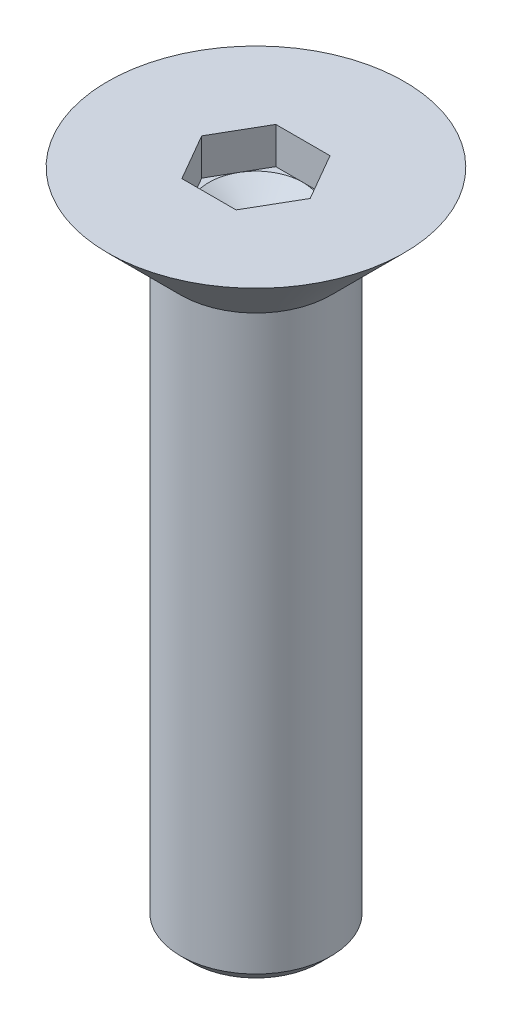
SolidWorks part; units mm, degrees
extrude "Base-Extrusion" add sketch "Esquisse2" against normal blind 35
sketch "Esquisse2" plane through (0, 0, 0) normal (0, 1, 0) x (1, 0, 0)
  circle A0 centre (0, 0) radius 4
  dimension "Diamètre nominal" = 8
chamfer "Chanfrein1" distance 0.625 angle 45
ref_plane "Plan1" through (0, 0, 0) normal (0, 0, 1) x (1, 0, 0)
ref_plane "Plan2" through (0, 0, 0) normal (0, 1, 0) x (1, 0, 0)
ref_plane "Plan3" through (0, 0, 0) normal (1, 0, 0) x (0, 0, -1)
sketch "Esquisse5" plane through (0, 0, 0) normal (0, 0, 1) x (1, 0, 0)
  line L0 (-7.9, 0) -> (7.9, 0) construction
  line L1 (0, 0) -> (7.9, 0)
  line L2 (7.9, 0) -> (4, -3.9)
  line L3 (4, -3.9) -> (0, -3.9)
  line L4 (4, -34.375) -> (4, 0) construction
  line L5 (0, -3.9) -> (0, 0)
  line L6 (0, 0) -> (0, -4.9812) construction
  line L8 (0, -34.375) -> (0, 0) construction
  line L9 (0, -4.9812) -> (0, 23.9688) construction
  line L10 (0, -34.375) -> (0, 0) construction
revolve "Boss.-Révol.1" add sketch "Esquisse5" angle 360 about L6
sketch "Esquisse7" plane through (0, 0, 0) normal (0, 1, 0) x (-1, 0, 0)
  circle A0 centre (0, 0) radius 2.5
  dimension "Cote sur plats" = 5
extrude "Enlèv. mat.-Extru.2" cut sketch "Esquisse7" against normal blind 1.95
sketch "Esquisse8" plane through (0, -1.95, 0) normal (0, 1, 0) x (-1, 0, 0)
  circle A0 centre (0, 0) radius 2.5
  circle A1 centre (0, 0) radius 2.5 construction
extrude "Enlèv. mat.-Extru.3" cut sketch "Esquisse8" against normal through all draft 60
sketch "Esquisse9" plane through (0, 0, 0) normal (0, 1, 0) x (-1, 0, 0)
  line L0 (0, -2.5) -> (0, 2.5) construction
  line L1 (2.5, 0) -> (-2.8868, 0) construction
  line L2 (0, 0) -> (-1.4434, 2.5) construction
  line L3 (0, 0) -> (-2.1651, 1.25) construction
  line L4 (1.4434, 2.5) -> (-1.4434, 2.5)
  line L5 (-1.4434, 2.5) -> (-2.8868, 0)
  line L6 (-1.4434, -2.5) -> (-2.8868, 0)
  line L7 (1.4434, -2.5) -> (-1.4434, -2.5)
  line L8 (1.4434, 2.5) -> (2.8868, 0)
  line L9 (1.4434, -2.5) -> (2.8868, 0)
  circle A0 centre (0, 0) radius 2.5 construction
  dimension "D1" = 30
  dimension "D2" = 30
extrude "Enlèv. mat.-Extru.4" cut sketch "Esquisse9" against normal blind 1.95
equation "\"D2@Esquisse5\" = \"Diamètre tête@Esquisse5\"/2"
equation "\"D1@Enlèv. mat.-Extru.2\" = (\"Diamètre tête@Esquisse5\"-\"Diamètre nominal@Esquisse2\")/4"
equation "\"D1@Enlèv. mat.-Extru.4\" = \"D1@Enlèv. mat.-Extru.2\""
equation "\"D2@Représentation de filetage1\" = \"Diamètre nominal@Esquisse2\"-(\"Diamètre nominal@Esquisse2\"*0.2)"
equation "\"Longueur filetée@Représentation de filetage1\" = \"Longueur filetée@Esquisse5\""
